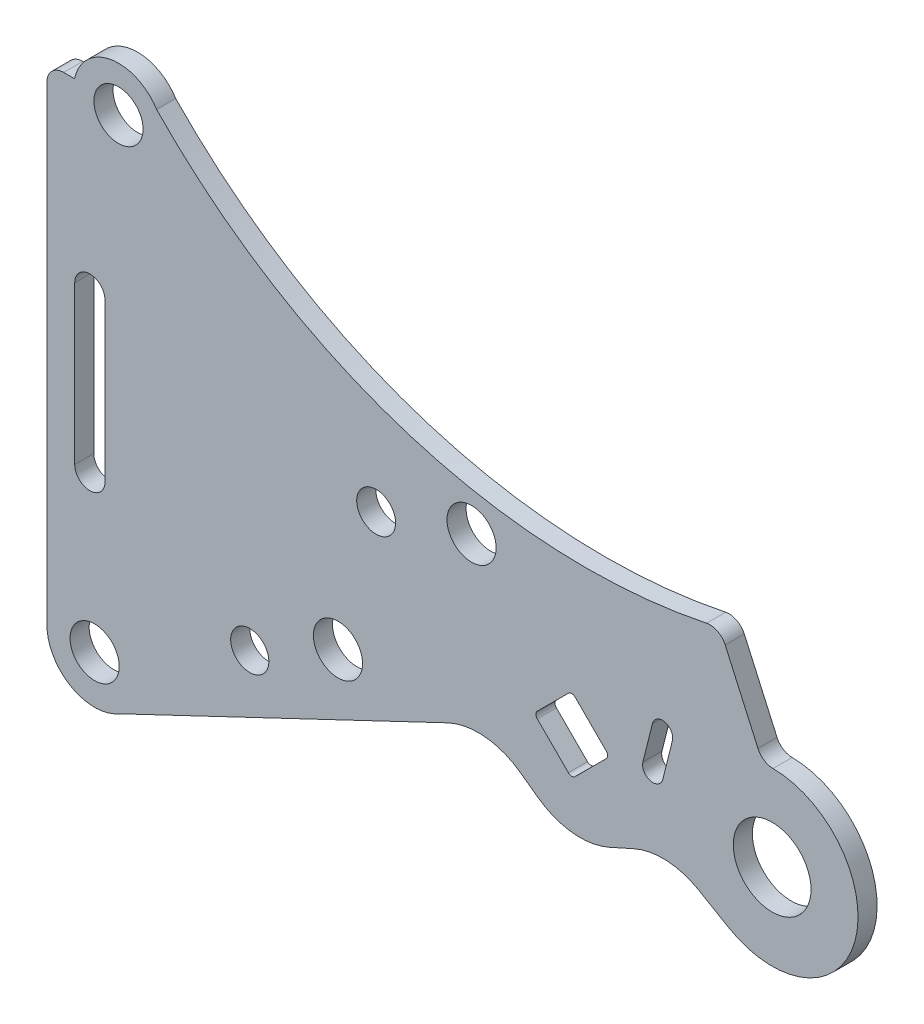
SolidWorks part; units mm, degrees
ref_plane "Plan de face" through (0, 0, 0) normal (0, 0, 1) x (1, 0, 0)
ref_plane "Plan de dessus" through (0, 0, 0) normal (0, 1, 0) x (1, 0, 0)
ref_plane "Plan de droite" through (0, 0, 0) normal (1, 0, 0) x (0, 0, -1)
sketch "Esquisse1" plane through (0, 0, 0) normal (0, 0, 1) x (1, 0, 0)
  line L0 (46, -74) -> (-5, -100) construction
  line L1 (-9.175, -68) -> (-9.175, -35)
  line L2 (-2.825, -35) -> (-2.825, -68)
  line L3 (87.7875, -65.7071) -> (94.2929, -72.2125)
  line L4 (87.7875, -64.2929) -> (94.2929, -57.7875)
  line L5 (95.7071, -72.2125) -> (102.2125, -65.7071)
  line L6 (95.7071, -57.7875) -> (102.2125, -64.2929)
  line L7 (95, -57.0804) -> (95, -72.9196) construction
  line L8 (102.9196, -65) -> (87.0804, -65) construction
  line L9 (111.9142, -54.4785) -> (109.9142, -62.4785)
  line L10 (116.0858, -55.5215) -> (114.0858, -63.5215)
  line L11 (134.0241, -47.9308) -> (127.1622, -32.597)
  line L12 (-9.2195, 2) -> (-11.5, 2)
  line L13 (-15, -1.5) -> (-15, -100)
  line L14 (0, -108.6603) -> (68.975, -75.8208)
  line L15 (84.2054, -77.2039) -> (87.9701, -79.9228)
  line L16 (102.9079, -81.4415) -> (107.9547, -79.1704)
  line L17 (121.6722, -79.8949) -> (127.9255, -83.5452)
  circle A0 centre (0, 0) radius 5.15
  circle A1 centre (-5, -100) radius 5.15
  circle A2 centre (46, -74) radius 5.15
  circle A3 centre (27.5181, -83.4222) radius 4
  circle A4 centre (54, -45) radius 4.075
  circle A5 centre (74, -39) radius 5.15
  circle A6 centre (137, -68) radius 8.15
  arc A7 (-2.825, -35) -> (-9.175, -35) centre (-6, -35) ccw
  arc A8 (-9.175, -68) -> (-2.825, -68) centre (-6, -68) ccw
  arc A9 (109.9142, -62.4785) -> (114.0858, -63.5215) centre (112, -63) ccw
  arc A10 (116.0858, -55.5215) -> (111.9142, -54.4785) centre (114, -55) ccw
  arc A11 (127.9255, -83.5452) -> (137.1832, -50.0009) centre (137, -68) ccw
  arc A12 (8, 5) -> (123.2585, -30.5992) centre (97.9393, 91.8097) ccw
  arc A13 (8, 5) -> (-9.2195, 2) centre (0, 0) ccw
  arc A14 (-15, -100) -> (0, -108.6603) centre (-5, -100) ccw
  arc A15 (-11.5, 2) -> (-15, -1.5) centre (-11.5, -1.5) ccw
  arc A16 (134.0241, -47.9308) -> (137.1832, -50.0009) centre (137.2188, -46.5011) ccw
  arc A17 (127.1622, -32.597) -> (123.2585, -30.5992) centre (123.9675, -34.0267) ccw
  arc A18 (107.9547, -79.1704) -> (121.6722, -79.8949) centre (114.1101, -92.8492) cw
  arc A19 (87.9701, -79.9228) -> (102.9079, -81.4415) centre (96.7524, -67.7626) ccw
  arc A20 (68.975, -75.8208) -> (84.2054, -77.2039) centre (75.4231, -89.3641) cw
  arc A21 (87.7875, -64.2929) -> (87.7875, -65.7071) centre (88.4946, -65) ccw
  arc A22 (94.2929, -72.2125) -> (95.7071, -72.2125) centre (95, -71.5054) ccw
  arc A23 (102.2125, -65.7071) -> (102.2125, -64.2929) centre (101.5054, -65) ccw
  arc A24 (94.2929, -57.7875) -> (95.7071, -57.7875) centre (95, -58.4946) cw
  point P16 (95, -65)
  point P46 (-15, 2)
  point P49 (135, -50.1115)
  point P52 (126, -30)
  point P55 (115, -76)
  point P58 (95, -85)
  point P61 (77, -72)
  dimension "D1" = 10.3
  dimension "D2" = 10.3
  dimension "D5" = 10.3
  dimension "D8" = 8
  dimension "D10" = 8.15
  dimension "D13" = 10.3
  dimension "D18" = 16.3
  dimension "D19" = 6.35
  dimension "D20" = 6.35
  dimension "D31" = 4.3
  dimension "D34" = 4.3
  dimension "D37" = 36
  dimension "D45" = 125
  dimension "D54" = 3.5
  dimension "D55" = 15
  dimension "D56" = 1
  dimension "D3" = 100
  dimension "D4" = 5
  dimension "D6" = 51
  dimension "D7" = 26
  dimension "D9" = 36.5
  dimension "D11" = 45
  dimension "D12" = 54
  dimension "D14" = 39
  dimension "D15" = 74
  dimension "D16" = 68
  dimension "D17" = 137
  dimension "D21" = 35
  dimension "D22" = 68
  dimension "D23" = 6
  dimension "D24" = 6
  dimension "D25" = 6.35
  dimension "D26" = 11.2
  dimension "D27" = 11.2
  dimension "D28" = 65
  dimension "D29" = 95
  dimension "D30" = 45
  dimension "D32" = 112
  dimension "D33" = 63
  dimension "D35" = 114
  dimension "D36" = 55
  dimension "D38" = 2
  dimension "D39" = 11
  dimension "D40" = 38
  dimension "D41" = 8
  dimension "D42" = 5
  dimension "D43" = 2
  dimension "D44" = 15
  dimension "D46" = 5
  dimension "D47" = 8.6603
  dimension "D48" = 77
  dimension "D49" = 28
  dimension "D50" = 100
  dimension "D51" = 15
  dimension "D52" = 24
  dimension "D53" = 120
extrude "Boss.-Extru.1" add sketch "Esquisse1" along normal blind 4
